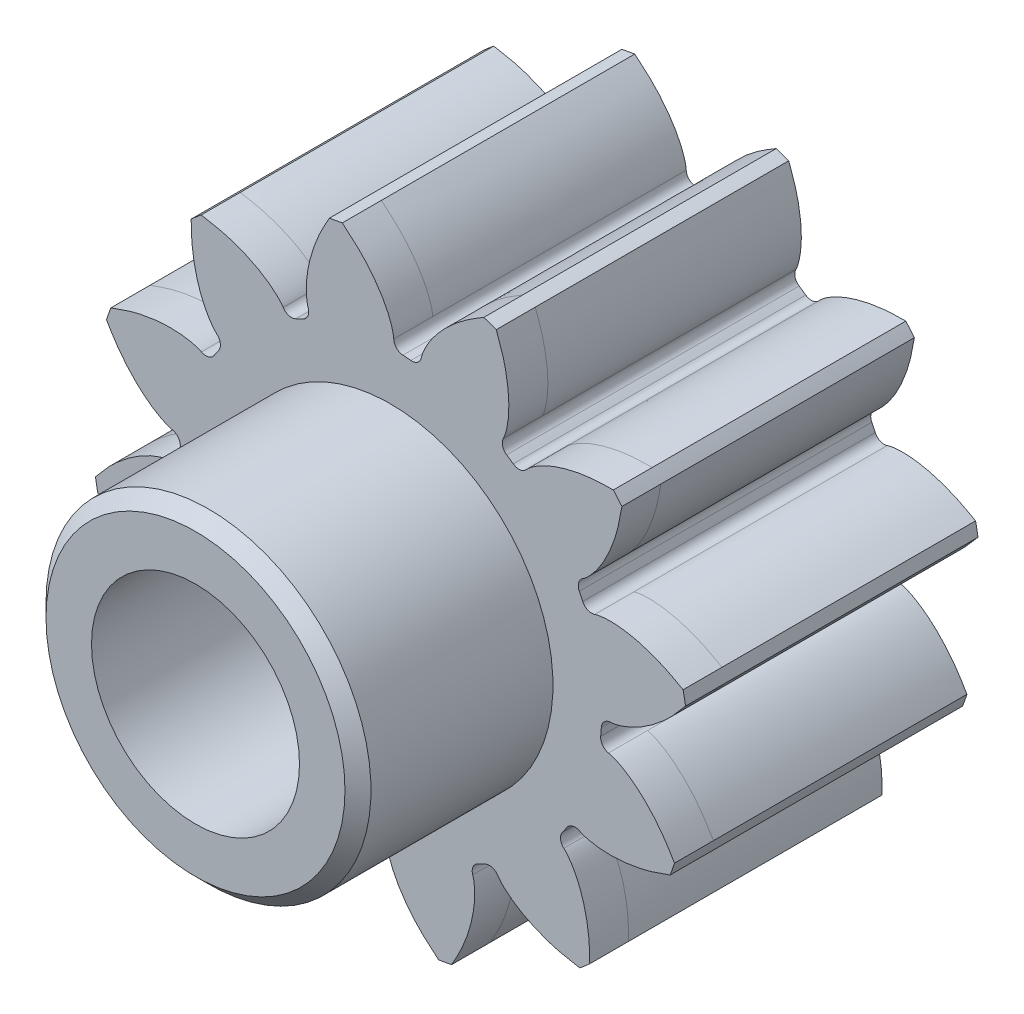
SolidWorks part; units mm, degrees
ref_plane "Face" through (0, 0, 0) normal (0, 0, 1) x (1, 0, 0)
ref_plane "Dessus" through (0, 0, 0) normal (0, 1, 0) x (1, 0, 0)
ref_plane "Droite" through (0, 0, 0) normal (1, 0, 0) x (0, 0, -1)
imported_body "Importée1"
sketch "Esquisse1" plane through (0, 0, 0) normal (0, 0, -1) x (-1, 0, 0)
  circle A0 centre (0, 0) radius 1.8425
  dimension "D1" = 3.685
surface "Surface-primitive" sketch "Esquisse1"
sketch "Esquisse2" plane through (0, 0, 0) normal (0, 0, -1) x (-1, 0, 0)
  arc A48 (-2.1849, -0.718) -> (-2.151, -0.8138) centre (0, 0) ccw
  arc A49 (-1.3568, -0.8938) -> (-1.4544, -0.8687) centre (-1.4194, -0.9351) ccw
  arc A50 (-1.3568, -0.8938) -> (-1.3221, -0.9444) centre (0, 0) ccw
  arc A51 (-1.3337, -1.0445) -> (-1.3221, -0.9444) centre (-1.3831, -0.988) ccw
  arc A52 (-1.5332, -1.7142) -> (-1.4559, -1.7803) centre (0, 0) ccw
  arc A53 (-0.7281, -1.4525) -> (-0.8252, -1.4795) centre (-0.7617, -1.5195) ccw
  arc A54 (-0.7281, -1.4525) -> (-0.6727, -1.4789) centre (0, 0) ccw
  arc A55 (-0.6328, -1.5714) -> (-0.6727, -1.4789) centre (-0.7038, -1.5472) ccw
  arc A56 (-0.4706, -2.2511) -> (-0.3707, -2.2697) centre (0, 0) ccw
  arc A57 (0.0956, -1.6219) -> (0.0251, -1.6939) centre (0.1001, -1.6968) ccw
  arc A58 (0.0956, -1.6219) -> (0.1569, -1.6172) centre (0, 0) ccw
  arc A59 (0.2377, -1.6773) -> (0.1569, -1.6172) centre (0.1641, -1.6918) ccw
  arc A60 (0.718, -2.1849) -> (0.8138, -2.151) centre (0, 0) ccw
  arc A61 (0.8938, -1.3568) -> (0.8687, -1.4544) centre (0.9351, -1.4194) ccw
  arc A62 (0.8938, -1.3568) -> (0.9444, -1.3221) centre (0, 0) ccw
  arc A63 (1.0445, -1.3337) -> (0.9444, -1.3221) centre (0.988, -1.3831) ccw
  arc A64 (1.7142, -1.5332) -> (1.7803, -1.4559) centre (0, 0) ccw
  arc A65 (1.4525, -0.7281) -> (1.4795, -0.8252) centre (1.5195, -0.7617) ccw
  arc A66 (1.4525, -0.7281) -> (1.4789, -0.6727) centre (0, 0) ccw
  arc A67 (1.5714, -0.6328) -> (1.4789, -0.6727) centre (1.5472, -0.7038) ccw
  arc A68 (2.2511, -0.4706) -> (2.2697, -0.3707) centre (0, 0) ccw
  arc A69 (1.6219, 0.0956) -> (1.6939, 0.0251) centre (1.6968, 0.1001) ccw
  arc A70 (1.6219, 0.0956) -> (1.6172, 0.1569) centre (0, 0) ccw
  arc A71 (1.6773, 0.2377) -> (1.6172, 0.1569) centre (1.6918, 0.1641) ccw
  arc A72 (2.1849, 0.718) -> (2.151, 0.8138) centre (0, 0) ccw
  arc A73 (1.3568, 0.8938) -> (1.4544, 0.8687) centre (1.4194, 0.9351) ccw
  arc A74 (1.3568, 0.8938) -> (1.3221, 0.9444) centre (0, 0) ccw
  arc A75 (1.3337, 1.0445) -> (1.3221, 0.9444) centre (1.3831, 0.988) ccw
  arc A76 (1.5332, 1.7142) -> (1.4559, 1.7803) centre (0, 0) ccw
  arc A77 (0.7281, 1.4525) -> (0.8252, 1.4795) centre (0.7617, 1.5195) ccw
  arc A78 (0.7281, 1.4525) -> (0.6727, 1.4789) centre (0, 0) ccw
  arc A79 (0.6328, 1.5714) -> (0.6727, 1.4789) centre (0.7038, 1.5472) ccw
  arc A80 (0.4706, 2.2511) -> (0.3707, 2.2697) centre (0, 0) ccw
  arc A81 (-0.0956, 1.6219) -> (-0.0251, 1.6939) centre (-0.1001, 1.6968) ccw
  arc A82 (-0.0956, 1.6219) -> (-0.1569, 1.6172) centre (0, 0) ccw
  arc A83 (-0.2377, 1.6773) -> (-0.1569, 1.6172) centre (-0.1641, 1.6918) ccw
  arc A84 (-0.718, 2.1849) -> (-0.8138, 2.151) centre (0, 0) ccw
  arc A85 (-0.8938, 1.3568) -> (-0.8687, 1.4544) centre (-0.9351, 1.4194) ccw
  arc A86 (-0.8938, 1.3568) -> (-0.9444, 1.3221) centre (0, 0) ccw
  arc A87 (-1.0445, 1.3337) -> (-0.9444, 1.3221) centre (-0.988, 1.3831) ccw
  arc A88 (-1.7142, 1.5332) -> (-1.7803, 1.4559) centre (0, 0) ccw
  arc A89 (-1.4525, 0.7281) -> (-1.4795, 0.8252) centre (-1.5195, 0.7617) ccw
  arc A90 (-1.4525, 0.7281) -> (-1.4789, 0.6727) centre (0, 0) ccw
  arc A91 (-1.5714, 0.6328) -> (-1.4789, 0.6727) centre (-1.5472, 0.7038) ccw
  arc A92 (-2.2511, 0.4706) -> (-2.2697, 0.3707) centre (0, 0) ccw
  arc A93 (-1.6219, -0.0956) -> (-1.6939, -0.0251) centre (-1.6968, -0.1001) ccw
  arc A94 (-1.6219, -0.0956) -> (-1.6172, -0.1569) centre (0, 0) ccw
  arc A95 (-1.6773, -0.2377) -> (-1.6172, -0.1569) centre (-1.6918, -0.1641) ccw
  arc A96 (-2.1849, -0.718) -> (-2.151, -0.8138) centre (0, 0) ccw
  arc A97 (-1.3568, -0.8938) -> (-1.4544, -0.8687) centre (-1.4194, -0.9351) ccw
  arc A98 (-1.3568, -0.8938) -> (-1.3221, -0.9444) centre (0, 0) ccw
  arc A99 (-1.3337, -1.0445) -> (-1.3221, -0.9444) centre (-1.3831, -0.988) ccw
  arc A100 (-1.5332, -1.7142) -> (-1.4559, -1.7803) centre (0, 0) ccw
  arc A101 (-0.7281, -1.4525) -> (-0.8252, -1.4795) centre (-0.7617, -1.5195) ccw
  arc A102 (-0.7281, -1.4525) -> (-0.6727, -1.4789) centre (0, 0) ccw
  arc A103 (-0.6328, -1.5714) -> (-0.6727, -1.4789) centre (-0.7038, -1.5472) ccw
  arc A104 (-0.4706, -2.2511) -> (-0.3707, -2.2697) centre (0, 0) ccw
  arc A105 (0.0956, -1.6219) -> (0.0251, -1.6939) centre (0.1001, -1.6968) ccw
  arc A106 (0.0956, -1.6219) -> (0.1569, -1.6172) centre (0, 0) ccw
  arc A107 (0.2377, -1.6773) -> (0.1569, -1.6172) centre (0.1641, -1.6918) ccw
  arc A108 (0.718, -2.1849) -> (0.8138, -2.151) centre (0, 0) ccw
  arc A109 (0.8938, -1.3568) -> (0.8687, -1.4544) centre (0.9351, -1.4194) ccw
  arc A110 (0.8938, -1.3568) -> (0.9444, -1.3221) centre (0, 0) ccw
  arc A111 (1.0445, -1.3337) -> (0.9444, -1.3221) centre (0.988, -1.3831) ccw
  arc A112 (1.7142, -1.5332) -> (1.7803, -1.4559) centre (0, 0) ccw
  arc A113 (1.4525, -0.7281) -> (1.4795, -0.8252) centre (1.5195, -0.7617) ccw
  arc A114 (1.4525, -0.7281) -> (1.4789, -0.6727) centre (0, 0) ccw
  arc A115 (1.5714, -0.6328) -> (1.4789, -0.6727) centre (1.5472, -0.7038) ccw
  arc A116 (2.2511, -0.4706) -> (2.2697, -0.3707) centre (0, 0) ccw
  arc A117 (1.6219, 0.0956) -> (1.6939, 0.0251) centre (1.6968, 0.1001) ccw
  arc A118 (1.6219, 0.0956) -> (1.6172, 0.1569) centre (0, 0) ccw
  arc A119 (1.6773, 0.2377) -> (1.6172, 0.1569) centre (1.6918, 0.1641) ccw
  arc A120 (2.1849, 0.718) -> (2.151, 0.8138) centre (0, 0) ccw
  arc A121 (1.3568, 0.8938) -> (1.4544, 0.8687) centre (1.4194, 0.9351) ccw
  arc A122 (1.3568, 0.8938) -> (1.3221, 0.9444) centre (0, 0) ccw
  arc A123 (1.3337, 1.0445) -> (1.3221, 0.9444) centre (1.3831, 0.988) ccw
  arc A124 (1.5332, 1.7142) -> (1.4559, 1.7803) centre (0, 0) ccw
  arc A125 (0.7281, 1.4525) -> (0.8252, 1.4795) centre (0.7617, 1.5195) ccw
  arc A126 (0.7281, 1.4525) -> (0.6727, 1.4789) centre (0, 0) ccw
  arc A127 (0.6328, 1.5714) -> (0.6727, 1.4789) centre (0.7038, 1.5472) ccw
  arc A128 (0.4706, 2.2511) -> (0.3707, 2.2697) centre (0, 0) ccw
  arc A129 (-0.0956, 1.6219) -> (-0.0251, 1.6939) centre (-0.1001, 1.6968) ccw
  arc A130 (-0.0956, 1.6219) -> (-0.1569, 1.6172) centre (0, 0) ccw
  arc A131 (-0.2377, 1.6773) -> (-0.1569, 1.6172) centre (-0.1641, 1.6918) ccw
  arc A132 (-0.718, 2.1849) -> (-0.8138, 2.151) centre (0, 0) ccw
  arc A133 (-0.8938, 1.3568) -> (-0.8687, 1.4544) centre (-0.9351, 1.4194) ccw
  arc A134 (-0.8938, 1.3568) -> (-0.9444, 1.3221) centre (0, 0) ccw
  arc A135 (-1.0445, 1.3337) -> (-0.9444, 1.3221) centre (-0.988, 1.3831) ccw
  arc A136 (-1.7142, 1.5332) -> (-1.7803, 1.4559) centre (0, 0) ccw
  arc A137 (-1.4525, 0.7281) -> (-1.4795, 0.8252) centre (-1.5195, 0.7617) ccw
  arc A138 (-1.4525, 0.7281) -> (-1.4789, 0.6727) centre (0, 0) ccw
  arc A139 (-1.5714, 0.6328) -> (-1.4789, 0.6727) centre (-1.5472, 0.7038) ccw
  arc A140 (-2.2511, 0.4706) -> (-2.2697, 0.3707) centre (0, 0) ccw
  arc A141 (-1.6219, -0.0956) -> (-1.6939, -0.0251) centre (-1.6968, -0.1001) ccw
  arc A142 (-1.6219, -0.0956) -> (-1.6172, -0.1569) centre (0, 0) ccw
  arc A143 (-1.6773, -0.2377) -> (-1.6172, -0.1569) centre (-1.6918, -0.1641) ccw
  spline S24 degree 3 poles (-1.6773, -0.2377) (-1.6854, -0.2393) (-1.7023, -0.244) (-1.7273, -0.2538) (-1.7531, -0.2654) (-1.8104, -0.2957) (-1.8965, -0.3557) (-2.0026, -0.4575) (-2.1015, -0.5788) (-2.1565, -0.6707) (-2.1849, -0.718) knots 0 0 0 0 0.021851 0.04651 0.071535 0.096971 0.218761 0.348799 0.487037 0.633438 0.633438 0.633438 0.633438
  spline S25 degree 3 poles (-2.151, -0.8138) (-2.0993, -0.8328) (-1.9987, -0.8698) (-1.8455, -0.902) (-1.699, -0.9145) (-1.5944, -0.9072) (-1.5308, -0.8947) (-1.5034, -0.8876) (-1.4778, -0.8795) (-1.4616, -0.8725) (-1.4544, -0.8687) knots 0.366562 0.366562 0.366562 0.366562 0.512963 0.651201 0.781239 0.903029 0.928465 0.95349 0.978149 1 1 1 1
  spline S26 degree 3 poles (-1.3337, -1.0445) (-1.3399, -1.0499) (-1.3522, -1.0624) (-1.369, -1.0835) (-1.3855, -1.1064) (-1.42, -1.1613) (-1.4645, -1.2563) (-1.5055, -1.3975) (-1.5306, -1.552) (-1.5323, -1.6591) (-1.5332, -1.7142) knots 0 0 0 0 0.021851 0.04651 0.071535 0.096971 0.218761 0.348799 0.487037 0.633438 0.633438 0.633438 0.633438
  spline S27 degree 3 poles (-1.4559, -1.7803) (-1.4016, -1.7709) (-1.296, -1.7526) (-1.1473, -1.7039) (-1.0141, -1.6415) (-0.9272, -1.5828) (-0.8783, -1.5402) (-0.8582, -1.5204) (-0.84, -1.5006) (-0.8296, -1.4864) (-0.8252, -1.4795) knots 0.366562 0.366562 0.366562 0.366562 0.512963 0.651201 0.781239 0.903029 0.928465 0.95349 0.978149 1 1 1 1
  spline S28 degree 3 poles (-0.6328, -1.5714) (-0.6355, -1.5792) (-0.6399, -1.5962) (-0.6439, -1.6228) (-0.6467, -1.651) (-0.6491, -1.7157) (-0.6402, -1.8202) (-0.6051, -1.963) (-0.5495, -2.1093) (-0.4974, -2.203) (-0.4706, -2.2511) knots 0 0 0 0 0.021851 0.04651 0.071535 0.096971 0.218761 0.348799 0.487037 0.633438 0.633438 0.633438 0.633438
  spline S29 degree 3 poles (-0.3707, -2.2697) (-0.3284, -2.2344) (-0.2461, -2.1658) (-0.1416, -2.0493) (-0.0575, -1.9287) (-0.0116, -1.8344) (0.0095, -1.7731) (0.017, -1.7458) (0.0228, -1.7195) (0.0248, -1.7021) (0.0251, -1.6939) knots 0.366562 0.366562 0.366562 0.366562 0.512963 0.651201 0.781239 0.903029 0.928465 0.95349 0.978149 1 1 1 1
  spline S30 degree 3 poles (0.2377, -1.6773) (0.2393, -1.6854) (0.244, -1.7023) (0.2538, -1.7273) (0.2654, -1.7531) (0.2957, -1.8104) (0.3557, -1.8965) (0.4575, -2.0026) (0.5788, -2.1015) (0.6707, -2.1565) (0.718, -2.1849) knots 0 0 0 0 0.021851 0.04651 0.071535 0.096971 0.218761 0.348799 0.487037 0.633438 0.633438 0.633438 0.633438
  spline S31 degree 3 poles (0.8138, -2.151) (0.8328, -2.0993) (0.8698, -1.9987) (0.902, -1.8455) (0.9145, -1.699) (0.9072, -1.5944) (0.8947, -1.5308) (0.8876, -1.5034) (0.8795, -1.4778) (0.8725, -1.4616) (0.8687, -1.4544) knots 0.366562 0.366562 0.366562 0.366562 0.512963 0.651201 0.781239 0.903029 0.928465 0.95349 0.978149 1 1 1 1
  spline S32 degree 3 poles (1.0445, -1.3337) (1.0499, -1.3399) (1.0624, -1.3522) (1.0835, -1.369) (1.1064, -1.3855) (1.1613, -1.42) (1.2563, -1.4645) (1.3975, -1.5055) (1.552, -1.5306) (1.6591, -1.5323) (1.7142, -1.5332) knots 0 0 0 0 0.021851 0.04651 0.071535 0.096971 0.218761 0.348799 0.487037 0.633438 0.633438 0.633438 0.633438
  spline S33 degree 3 poles (1.7803, -1.4559) (1.7709, -1.4016) (1.7526, -1.296) (1.7039, -1.1473) (1.6415, -1.0141) (1.5828, -0.9272) (1.5402, -0.8783) (1.5204, -0.8582) (1.5006, -0.84) (1.4864, -0.8296) (1.4795, -0.8252) knots 0.366562 0.366562 0.366562 0.366562 0.512963 0.651201 0.781239 0.903029 0.928465 0.95349 0.978149 1 1 1 1
  spline S34 degree 3 poles (1.5714, -0.6328) (1.5792, -0.6355) (1.5962, -0.6399) (1.6228, -0.6439) (1.651, -0.6467) (1.7157, -0.6491) (1.8202, -0.6402) (1.963, -0.6051) (2.1093, -0.5495) (2.203, -0.4974) (2.2511, -0.4706) knots 0 0 0 0 0.021851 0.04651 0.071535 0.096971 0.218761 0.348799 0.487037 0.633438 0.633438 0.633438 0.633438
  spline S35 degree 3 poles (2.2697, -0.3707) (2.2344, -0.3284) (2.1658, -0.2461) (2.0493, -0.1416) (1.9287, -0.0575) (1.8344, -0.0116) (1.7731, 0.0095) (1.7458, 0.017) (1.7195, 0.0228) (1.7021, 0.0248) (1.6939, 0.0251) knots 0.366562 0.366562 0.366562 0.366562 0.512963 0.651201 0.781239 0.903029 0.928465 0.95349 0.978149 1 1 1 1
  spline S36 degree 3 poles (1.6773, 0.2377) (1.6854, 0.2393) (1.7023, 0.244) (1.7273, 0.2538) (1.7531, 0.2654) (1.8104, 0.2957) (1.8965, 0.3557) (2.0026, 0.4575) (2.1015, 0.5788) (2.1565, 0.6707) (2.1849, 0.718) knots 0 0 0 0 0.021851 0.04651 0.071535 0.096971 0.218761 0.348799 0.487037 0.633438 0.633438 0.633438 0.633438
  spline S37 degree 3 poles (2.151, 0.8138) (2.0993, 0.8328) (1.9987, 0.8698) (1.8455, 0.902) (1.699, 0.9145) (1.5944, 0.9072) (1.5308, 0.8947) (1.5034, 0.8876) (1.4778, 0.8795) (1.4616, 0.8725) (1.4544, 0.8687) knots 0.366562 0.366562 0.366562 0.366562 0.512963 0.651201 0.781239 0.903029 0.928465 0.95349 0.978149 1 1 1 1
  spline S38 degree 3 poles (1.3337, 1.0445) (1.3399, 1.0499) (1.3522, 1.0624) (1.369, 1.0835) (1.3855, 1.1064) (1.42, 1.1613) (1.4645, 1.2563) (1.5055, 1.3975) (1.5306, 1.552) (1.5323, 1.6591) (1.5332, 1.7142) knots 0 0 0 0 0.021851 0.04651 0.071535 0.096971 0.218761 0.348799 0.487037 0.633438 0.633438 0.633438 0.633438
  spline S39 degree 3 poles (1.4559, 1.7803) (1.4016, 1.7709) (1.296, 1.7526) (1.1473, 1.7039) (1.0141, 1.6415) (0.9272, 1.5828) (0.8783, 1.5402) (0.8582, 1.5204) (0.84, 1.5006) (0.8296, 1.4864) (0.8252, 1.4795) knots 0.366562 0.366562 0.366562 0.366562 0.512963 0.651201 0.781239 0.903029 0.928465 0.95349 0.978149 1 1 1 1
  spline S40 degree 3 poles (0.6328, 1.5714) (0.6355, 1.5792) (0.6399, 1.5962) (0.6439, 1.6228) (0.6467, 1.651) (0.6491, 1.7157) (0.6402, 1.8202) (0.6051, 1.963) (0.5495, 2.1093) (0.4974, 2.203) (0.4706, 2.2511) knots 0 0 0 0 0.021851 0.04651 0.071535 0.096971 0.218761 0.348799 0.487037 0.633438 0.633438 0.633438 0.633438
  spline S41 degree 3 poles (0.3707, 2.2697) (0.3284, 2.2344) (0.2461, 2.1658) (0.1416, 2.0493) (0.0575, 1.9287) (0.0116, 1.8344) (-0.0095, 1.7731) (-0.017, 1.7458) (-0.0228, 1.7195) (-0.0248, 1.7021) (-0.0251, 1.6939) knots 0.366562 0.366562 0.366562 0.366562 0.512963 0.651201 0.781239 0.903029 0.928465 0.95349 0.978149 1 1 1 1
  spline S42 degree 3 poles (-0.2377, 1.6773) (-0.2393, 1.6854) (-0.244, 1.7023) (-0.2538, 1.7273) (-0.2654, 1.7531) (-0.2957, 1.8104) (-0.3557, 1.8965) (-0.4575, 2.0026) (-0.5788, 2.1015) (-0.6707, 2.1565) (-0.718, 2.1849) knots 0 0 0 0 0.021851 0.04651 0.071535 0.096971 0.218761 0.348799 0.487037 0.633438 0.633438 0.633438 0.633438
  spline S43 degree 3 poles (-0.8138, 2.151) (-0.8328, 2.0993) (-0.8698, 1.9987) (-0.902, 1.8455) (-0.9145, 1.699) (-0.9072, 1.5944) (-0.8947, 1.5308) (-0.8876, 1.5034) (-0.8795, 1.4778) (-0.8725, 1.4616) (-0.8687, 1.4544) knots 0.366562 0.366562 0.366562 0.366562 0.512963 0.651201 0.781239 0.903029 0.928465 0.95349 0.978149 1 1 1 1
  spline S44 degree 3 poles (-1.0445, 1.3337) (-1.0499, 1.3399) (-1.0624, 1.3522) (-1.0835, 1.369) (-1.1064, 1.3855) (-1.1613, 1.42) (-1.2563, 1.4645) (-1.3975, 1.5055) (-1.552, 1.5306) (-1.6591, 1.5323) (-1.7142, 1.5332) knots 0 0 0 0 0.021851 0.04651 0.071535 0.096971 0.218761 0.348799 0.487037 0.633438 0.633438 0.633438 0.633438
  spline S45 degree 3 poles (-1.7803, 1.4559) (-1.7709, 1.4016) (-1.7526, 1.296) (-1.7039, 1.1473) (-1.6415, 1.0141) (-1.5828, 0.9272) (-1.5402, 0.8783) (-1.5204, 0.8582) (-1.5006, 0.84) (-1.4864, 0.8296) (-1.4795, 0.8252) knots 0.366562 0.366562 0.366562 0.366562 0.512963 0.651201 0.781239 0.903029 0.928465 0.95349 0.978149 1 1 1 1
  spline S46 degree 3 poles (-1.5714, 0.6328) (-1.5792, 0.6355) (-1.5962, 0.6399) (-1.6228, 0.6439) (-1.651, 0.6467) (-1.7157, 0.6491) (-1.8202, 0.6402) (-1.963, 0.6051) (-2.1093, 0.5495) (-2.203, 0.4974) (-2.2511, 0.4706) knots 0 0 0 0 0.021851 0.04651 0.071535 0.096971 0.218761 0.348799 0.487037 0.633438 0.633438 0.633438 0.633438
  spline S47 degree 3 poles (-2.2697, 0.3707) (-2.2344, 0.3284) (-2.1658, 0.2461) (-2.0493, 0.1416) (-1.9287, 0.0575) (-1.8344, 0.0116) (-1.7731, -0.0095) (-1.7458, -0.017) (-1.7195, -0.0228) (-1.7021, -0.0248) (-1.6939, -0.0251) knots 0.366562 0.366562 0.366562 0.366562 0.512963 0.651201 0.781239 0.903029 0.928465 0.95349 0.978149 1 1 1 1
  spline S48 degree 3 poles (-1.6773, -0.2377) (-1.6854, -0.2393) (-1.7023, -0.244) (-1.7273, -0.2538) (-1.7531, -0.2654) (-1.8104, -0.2957) (-1.8965, -0.3557) (-2.0026, -0.4575) (-2.1015, -0.5788) (-2.1565, -0.6707) (-2.1849, -0.718) knots 0 0 0 0 0.021851 0.04651 0.071535 0.096971 0.218761 0.348799 0.487037 0.633438 0.633438 0.633438 0.633438
  spline S49 degree 3 poles (-2.151, -0.8138) (-2.0993, -0.8328) (-1.9987, -0.8698) (-1.8455, -0.902) (-1.699, -0.9145) (-1.5944, -0.9072) (-1.5308, -0.8947) (-1.5034, -0.8876) (-1.4778, -0.8795) (-1.4616, -0.8725) (-1.4544, -0.8687) knots 0.366562 0.366562 0.366562 0.366562 0.512963 0.651201 0.781239 0.903029 0.928465 0.95349 0.978149 1 1 1 1
  spline S50 degree 3 poles (-1.3337, -1.0445) (-1.3399, -1.0499) (-1.3522, -1.0624) (-1.369, -1.0835) (-1.3855, -1.1064) (-1.42, -1.1613) (-1.4645, -1.2563) (-1.5055, -1.3975) (-1.5306, -1.552) (-1.5323, -1.6591) (-1.5332, -1.7142) knots 0 0 0 0 0.021851 0.04651 0.071535 0.096971 0.218761 0.348799 0.487037 0.633438 0.633438 0.633438 0.633438
  spline S51 degree 3 poles (-1.4559, -1.7803) (-1.4016, -1.7709) (-1.296, -1.7526) (-1.1473, -1.7039) (-1.0141, -1.6415) (-0.9272, -1.5828) (-0.8783, -1.5402) (-0.8582, -1.5204) (-0.84, -1.5006) (-0.8296, -1.4864) (-0.8252, -1.4795) knots 0.366562 0.366562 0.366562 0.366562 0.512963 0.651201 0.781239 0.903029 0.928465 0.95349 0.978149 1 1 1 1
  spline S52 degree 3 poles (-0.6328, -1.5714) (-0.6355, -1.5792) (-0.6399, -1.5962) (-0.6439, -1.6228) (-0.6467, -1.651) (-0.6491, -1.7157) (-0.6402, -1.8202) (-0.6051, -1.963) (-0.5495, -2.1093) (-0.4974, -2.203) (-0.4706, -2.2511) knots 0 0 0 0 0.021851 0.04651 0.071535 0.096971 0.218761 0.348799 0.487037 0.633438 0.633438 0.633438 0.633438
  spline S53 degree 3 poles (-0.3707, -2.2697) (-0.3284, -2.2344) (-0.2461, -2.1658) (-0.1416, -2.0493) (-0.0575, -1.9287) (-0.0116, -1.8344) (0.0095, -1.7731) (0.017, -1.7458) (0.0228, -1.7195) (0.0248, -1.7021) (0.0251, -1.6939) knots 0.366562 0.366562 0.366562 0.366562 0.512963 0.651201 0.781239 0.903029 0.928465 0.95349 0.978149 1 1 1 1
  spline S54 degree 3 poles (0.2377, -1.6773) (0.2393, -1.6854) (0.244, -1.7023) (0.2538, -1.7273) (0.2654, -1.7531) (0.2957, -1.8104) (0.3557, -1.8965) (0.4575, -2.0026) (0.5788, -2.1015) (0.6707, -2.1565) (0.718, -2.1849) knots 0 0 0 0 0.021851 0.04651 0.071535 0.096971 0.218761 0.348799 0.487037 0.633438 0.633438 0.633438 0.633438
  spline S55 degree 3 poles (0.8138, -2.151) (0.8328, -2.0993) (0.8698, -1.9987) (0.902, -1.8455) (0.9145, -1.699) (0.9072, -1.5944) (0.8947, -1.5308) (0.8876, -1.5034) (0.8795, -1.4778) (0.8725, -1.4616) (0.8687, -1.4544) knots 0.366562 0.366562 0.366562 0.366562 0.512963 0.651201 0.781239 0.903029 0.928465 0.95349 0.978149 1 1 1 1
  spline S56 degree 3 poles (1.0445, -1.3337) (1.0499, -1.3399) (1.0624, -1.3522) (1.0835, -1.369) (1.1064, -1.3855) (1.1613, -1.42) (1.2563, -1.4645) (1.3975, -1.5055) (1.552, -1.5306) (1.6591, -1.5323) (1.7142, -1.5332) knots 0 0 0 0 0.021851 0.04651 0.071535 0.096971 0.218761 0.348799 0.487037 0.633438 0.633438 0.633438 0.633438
  spline S57 degree 3 poles (1.7803, -1.4559) (1.7709, -1.4016) (1.7526, -1.296) (1.7039, -1.1473) (1.6415, -1.0141) (1.5828, -0.9272) (1.5402, -0.8783) (1.5204, -0.8582) (1.5006, -0.84) (1.4864, -0.8296) (1.4795, -0.8252) knots 0.366562 0.366562 0.366562 0.366562 0.512963 0.651201 0.781239 0.903029 0.928465 0.95349 0.978149 1 1 1 1
  spline S58 degree 3 poles (1.5714, -0.6328) (1.5792, -0.6355) (1.5962, -0.6399) (1.6228, -0.6439) (1.651, -0.6467) (1.7157, -0.6491) (1.8202, -0.6402) (1.963, -0.6051) (2.1093, -0.5495) (2.203, -0.4974) (2.2511, -0.4706) knots 0 0 0 0 0.021851 0.04651 0.071535 0.096971 0.218761 0.348799 0.487037 0.633438 0.633438 0.633438 0.633438
  spline S59 degree 3 poles (2.2697, -0.3707) (2.2344, -0.3284) (2.1658, -0.2461) (2.0493, -0.1416) (1.9287, -0.0575) (1.8344, -0.0116) (1.7731, 0.0095) (1.7458, 0.017) (1.7195, 0.0228) (1.7021, 0.0248) (1.6939, 0.0251) knots 0.366562 0.366562 0.366562 0.366562 0.512963 0.651201 0.781239 0.903029 0.928465 0.95349 0.978149 1 1 1 1
  spline S60 degree 3 poles (1.6773, 0.2377) (1.6854, 0.2393) (1.7023, 0.244) (1.7273, 0.2538) (1.7531, 0.2654) (1.8104, 0.2957) (1.8965, 0.3557) (2.0026, 0.4575) (2.1015, 0.5788) (2.1565, 0.6707) (2.1849, 0.718) knots 0 0 0 0 0.021851 0.04651 0.071535 0.096971 0.218761 0.348799 0.487037 0.633438 0.633438 0.633438 0.633438
  spline S61 degree 3 poles (2.151, 0.8138) (2.0993, 0.8328) (1.9987, 0.8698) (1.8455, 0.902) (1.699, 0.9145) (1.5944, 0.9072) (1.5308, 0.8947) (1.5034, 0.8876) (1.4778, 0.8795) (1.4616, 0.8725) (1.4544, 0.8687) knots 0.366562 0.366562 0.366562 0.366562 0.512963 0.651201 0.781239 0.903029 0.928465 0.95349 0.978149 1 1 1 1
  spline S62 degree 3 poles (1.3337, 1.0445) (1.3399, 1.0499) (1.3522, 1.0624) (1.369, 1.0835) (1.3855, 1.1064) (1.42, 1.1613) (1.4645, 1.2563) (1.5055, 1.3975) (1.5306, 1.552) (1.5323, 1.6591) (1.5332, 1.7142) knots 0 0 0 0 0.021851 0.04651 0.071535 0.096971 0.218761 0.348799 0.487037 0.633438 0.633438 0.633438 0.633438
  spline S63 degree 3 poles (1.4559, 1.7803) (1.4016, 1.7709) (1.296, 1.7526) (1.1473, 1.7039) (1.0141, 1.6415) (0.9272, 1.5828) (0.8783, 1.5402) (0.8582, 1.5204) (0.84, 1.5006) (0.8296, 1.4864) (0.8252, 1.4795) knots 0.366562 0.366562 0.366562 0.366562 0.512963 0.651201 0.781239 0.903029 0.928465 0.95349 0.978149 1 1 1 1
  spline S64 degree 3 poles (0.6328, 1.5714) (0.6355, 1.5792) (0.6399, 1.5962) (0.6439, 1.6228) (0.6467, 1.651) (0.6491, 1.7157) (0.6402, 1.8202) (0.6051, 1.963) (0.5495, 2.1093) (0.4974, 2.203) (0.4706, 2.2511) knots 0 0 0 0 0.021851 0.04651 0.071535 0.096971 0.218761 0.348799 0.487037 0.633438 0.633438 0.633438 0.633438
  spline S65 degree 3 poles (0.3707, 2.2697) (0.3284, 2.2344) (0.2461, 2.1658) (0.1416, 2.0493) (0.0575, 1.9287) (0.0116, 1.8344) (-0.0095, 1.7731) (-0.017, 1.7458) (-0.0228, 1.7195) (-0.0248, 1.7021) (-0.0251, 1.6939) knots 0.366562 0.366562 0.366562 0.366562 0.512963 0.651201 0.781239 0.903029 0.928465 0.95349 0.978149 1 1 1 1
  spline S66 degree 3 poles (-0.2377, 1.6773) (-0.2393, 1.6854) (-0.244, 1.7023) (-0.2538, 1.7273) (-0.2654, 1.7531) (-0.2957, 1.8104) (-0.3557, 1.8965) (-0.4575, 2.0026) (-0.5788, 2.1015) (-0.6707, 2.1565) (-0.718, 2.1849) knots 0 0 0 0 0.021851 0.04651 0.071535 0.096971 0.218761 0.348799 0.487037 0.633438 0.633438 0.633438 0.633438
  spline S67 degree 3 poles (-0.8138, 2.151) (-0.8328, 2.0993) (-0.8698, 1.9987) (-0.902, 1.8455) (-0.9145, 1.699) (-0.9072, 1.5944) (-0.8947, 1.5308) (-0.8876, 1.5034) (-0.8795, 1.4778) (-0.8725, 1.4616) (-0.8687, 1.4544) knots 0.366562 0.366562 0.366562 0.366562 0.512963 0.651201 0.781239 0.903029 0.928465 0.95349 0.978149 1 1 1 1
  spline S68 degree 3 poles (-1.0445, 1.3337) (-1.0499, 1.3399) (-1.0624, 1.3522) (-1.0835, 1.369) (-1.1064, 1.3855) (-1.1613, 1.42) (-1.2563, 1.4645) (-1.3975, 1.5055) (-1.552, 1.5306) (-1.6591, 1.5323) (-1.7142, 1.5332) knots 0 0 0 0 0.021851 0.04651 0.071535 0.096971 0.218761 0.348799 0.487037 0.633438 0.633438 0.633438 0.633438
  spline S69 degree 3 poles (-1.7803, 1.4559) (-1.7709, 1.4016) (-1.7526, 1.296) (-1.7039, 1.1473) (-1.6415, 1.0141) (-1.5828, 0.9272) (-1.5402, 0.8783) (-1.5204, 0.8582) (-1.5006, 0.84) (-1.4864, 0.8296) (-1.4795, 0.8252) knots 0.366562 0.366562 0.366562 0.366562 0.512963 0.651201 0.781239 0.903029 0.928465 0.95349 0.978149 1 1 1 1
  spline S70 degree 3 poles (-1.5714, 0.6328) (-1.5792, 0.6355) (-1.5962, 0.6399) (-1.6228, 0.6439) (-1.651, 0.6467) (-1.7157, 0.6491) (-1.8202, 0.6402) (-1.963, 0.6051) (-2.1093, 0.5495) (-2.203, 0.4974) (-2.2511, 0.4706) knots 0 0 0 0 0.021851 0.04651 0.071535 0.096971 0.218761 0.348799 0.487037 0.633438 0.633438 0.633438 0.633438
  spline S71 degree 3 poles (-2.2697, 0.3707) (-2.2344, 0.3284) (-2.1658, 0.2461) (-2.0493, 0.1416) (-1.9287, 0.0575) (-1.8344, 0.0116) (-1.7731, -0.0095) (-1.7458, -0.017) (-1.7195, -0.0228) (-1.7021, -0.0248) (-1.6939, -0.0251) knots 0.366562 0.366562 0.366562 0.366562 0.512963 0.651201 0.781239 0.903029 0.928465 0.95349 0.978149 1 1 1 1
  dimension "D1" = 0
extrude "Enlèv. mat.-Extru.1" cut sketch "Esquisse2" against normal blind 0.15
